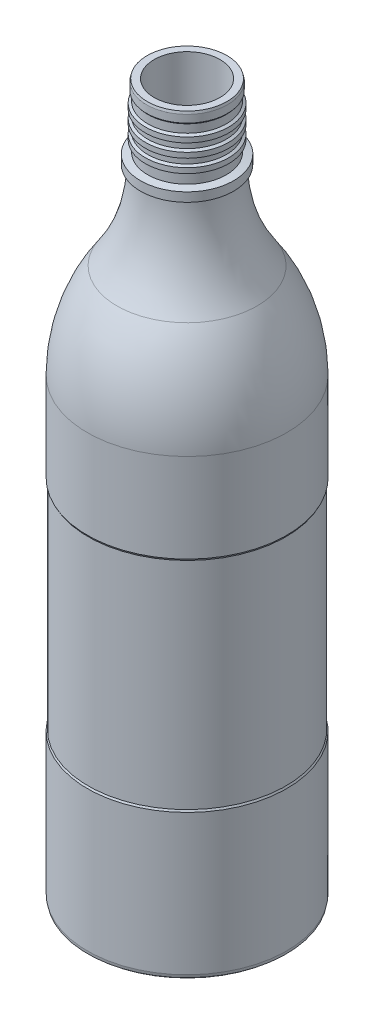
SolidWorks part; units mm, degrees
ref_plane "前视基准面" through (0, 0, 0) normal (0, 0, 1) x (1, 0, 0)
ref_plane "上视基准面" through (0, 0, 0) normal (0, 1, 0) x (1, 0, 0)
ref_plane "右视基准面" through (0, 0, 0) normal (1, 0, 0) x (0, 0, -1)
other "Configuration Table"
sketch "草图1" plane through (0, 0, 0) normal (0, 0, 1) x (1, 0, 0)
  line L0 (0, -10) -> (0, 245) construction
  line L1 (0, 8) -> (21, 8)
  line L2 (21, 8) -> (24.5, 7.4)
  line L3 (24.5, 7.4) -> (27.5, 5)
  line L4 (27.5, 5) -> (29, 1.2)
  line L5 (29, 1.2) -> (30.5, 0)
  line L6 (30.5, 0) -> (32.2, 0)
  line L7 (32.2, 0) -> (32.8, 0.5)
  line L8 (32.8, 0.5) -> (33, 1.5)
  line L9 (33, 1.5) -> (33, 48)
  line L10 (33, 48) -> (32.7, 48.6)
  line L11 (32.7, 48.6) -> (32.7, 120)
  line L12 (32.7, 120) -> (33, 120.6)
  line L13 (33, 120.6) -> (33, 150)
  line L14 (14.2, 210) -> (15.4, 210.4)
  line L15 (15.4, 210.4) -> (15.4, 213.4)
  line L16 (15.4, 213.4) -> (13, 213.9)
  line L17 (13, 213.9) -> (13, 217)
  line L18 (13, 217) -> (13.8, 217.5)
  line L19 (13.8, 217.5) -> (13.8, 219.2)
  line L20 (13.8, 219.2) -> (13, 219.7)
  line L21 (13, 219.7) -> (13, 221.4)
  line L22 (13, 221.4) -> (13.8, 221.9)
  line L23 (13.8, 221.9) -> (13.8, 223.6)
  line L24 (13.8, 223.6) -> (13, 224.1)
  line L25 (13, 224.1) -> (13, 225.8)
  line L26 (13, 225.8) -> (13.8, 226.3)
  line L27 (13.8, 226.3) -> (13.8, 228)
  line L28 (13.8, 228) -> (13, 228.5)
  line L29 (13, 228.5) -> (13, 231.2)
  line L30 (13, 231.2) -> (13.4, 231.7)
  line L31 (13.4, 231.7) -> (13.4, 234.2)
  line L32 (13.4, 234.2) -> (13.2, 235)
  line L33 (13.2, 235) -> (10.9, 235)
  line L34 (10.9, 235) -> (10.9, 211.2)
  line L35 (32.2, 151.2) -> (32.2, 120)
  line L36 (32.2, 120) -> (31.9, 119.4)
  line L37 (31.9, 119.4) -> (31.9, 48.6)
  line L38 (31.9, 48.6) -> (32.2, 48)
  line L39 (32.2, 48) -> (32.2, 12)
  line L40 (32.2, 12) -> (31.5, 10.6)
  line L41 (31.5, 10.6) -> (30, 9.6)
  line L42 (30, 9.6) -> (28, 9)
  line L43 (28, 9) -> (25, 8.8)
  line L44 (25, 8.8) -> (0, 8.8)
  line L45 (0, 8.8) -> (0, 8)
  arc A0 (33, 150) -> (23.1659, 181.3853) centre (-22, 150) ccw
  arc A1 (23.1659, 181.3853) -> (14.2, 210) centre (64.3447, 210) cw
  arc A2 (10.9, 211.2) -> (21.008, 182.7268) centre (56.057, 211.2) ccw
  arc A3 (21.008, 182.7268) -> (32.2, 151.2) centre (-17.8, 151.2) cw
revolve "旋转1" add sketch "草图1" angle 360 about L0
